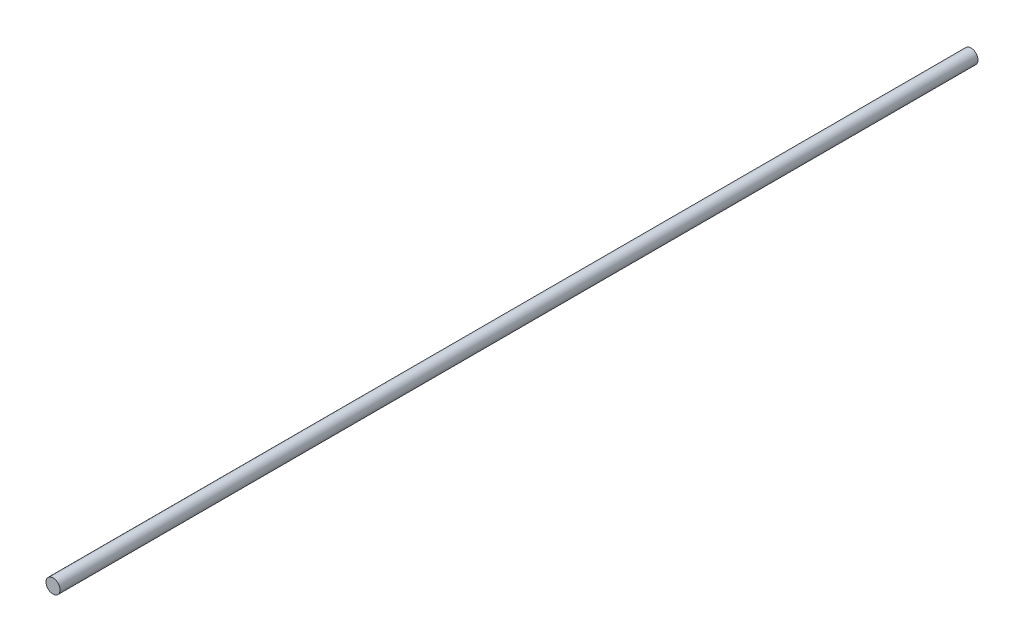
SolidWorks part; units mm, degrees
ref_plane "Front Plane" through (0, 0, 0) normal (0, 0, 1) x (1, 0, 0)
ref_plane "Top Plane" through (0, 0, 0) normal (0, 1, 0) x (1, 0, 0)
ref_plane "Right Plane" through (0, 0, 0) normal (1, 0, 0) x (0, 0, -1)
sketch "Sketch1" plane through (0, 0, 0) normal (0, 0, 1) x (1, 0, 0)
  circle A0 centre (0, 0) radius 1.4
  dimension "D1" = 2.8
extrude "Boss-Extrude1" add sketch "Sketch1" along normal blind 182.88
